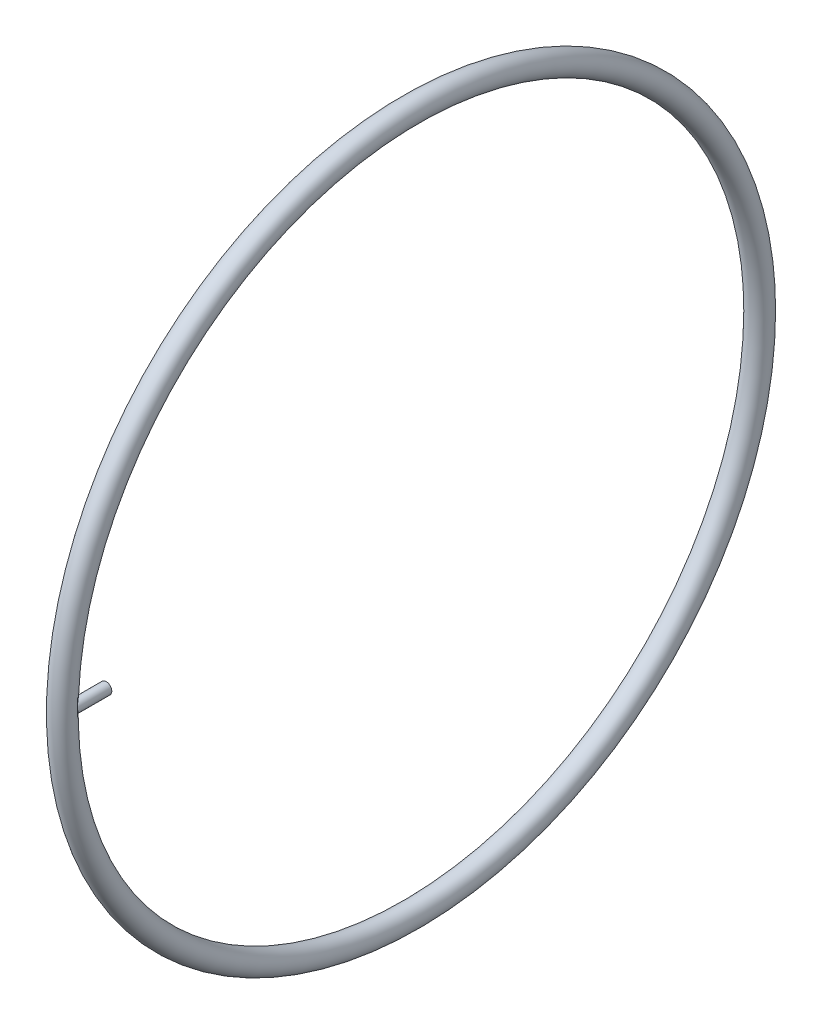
SolidWorks part; units mm, degrees
ref_plane "Front Plane" through (0, 0, 0) normal (0, 0, 1) x (1, 0, 0)
ref_plane "Top Plane" through (0, 0, 0) normal (0, 1, 0) x (1, 0, 0)
ref_plane "Right Plane" through (0, 0, 0) normal (1, 0, 0) x (0, 0, -1)
sketch "Sketch1" plane through (0, 0, 0) normal (0, 1, 0) x (1, 0, 0)
  line L0 (0, 0) -> (0, 330) construction
  circle A0 centre (0, 310) radius 10
  circle A1 centre (0, 310) radius 9
  dimension "D2" = 20
  dimension "D1" = 18
  dimension "D3" = 310
sketch "Sketch2" plane through (0, 0, 0) normal (1, 0, 0) x (0, 0, -1)
  circle A0 centre (0, 0) radius 341.0574
sweep "camera" add profiles "Sketch1" path "Sketch2"
ref_plane "Plane1" through (0, 0, 271) normal (0, 0, 1) x (1, 0, 0)
sketch "valva" plane through (0, 0, 271) normal (0, 0, 1) x (1, 0, 0)
  circle A0 centre (0, 0) radius 5
  dimension "D1" = 10
extrude "Boss-Extrude1" add sketch "valva" along normal up to next
sketch "Sketch4" plane through (0, 0, 271) normal (0, 0, -1) x (-1, 0, 0)
  circle A0 centre (0, 0) radius 4
  dimension "D1" = 8
extrude "Cut-Extrude1" cut sketch "Sketch4" against normal up to next
